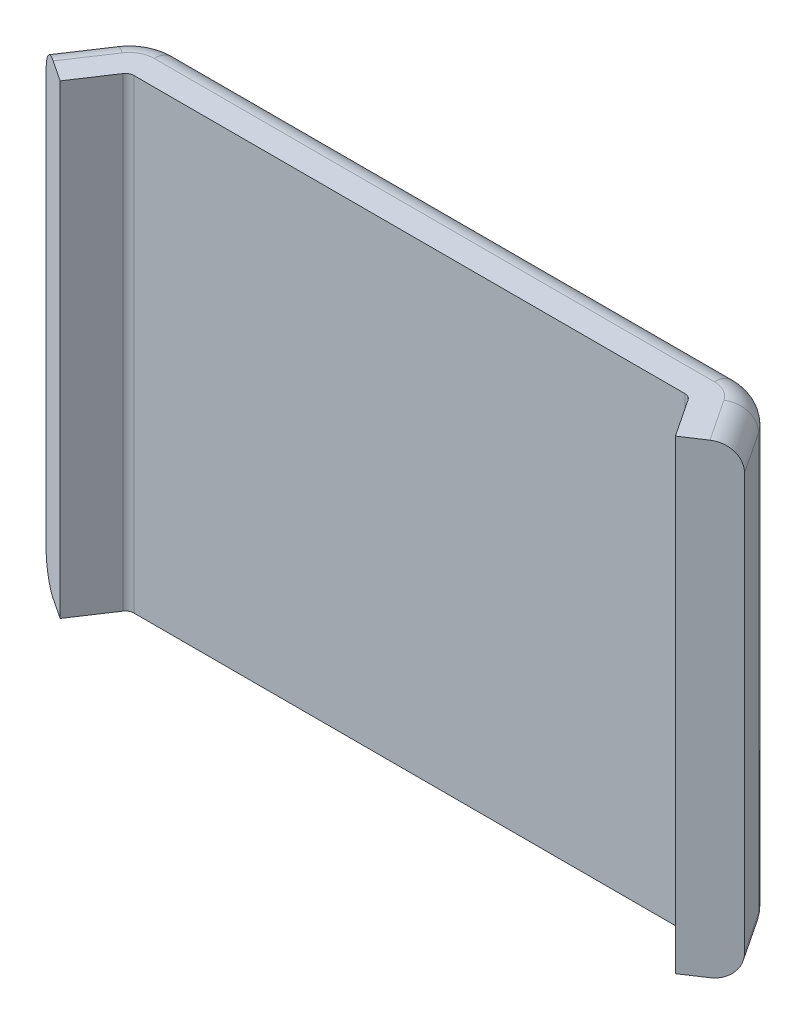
SolidWorks part; units mm, degrees
other "Solid1"
ref_plane "Front Plane" through (0, 0, 0) normal (0, 0, 1) x (1, 0, 0)
ref_plane "Top Plane" through (0, 0, 0) normal (0, 1, 0) x (1, 0, 0)
ref_plane "Right Plane" through (0, 0, 0) normal (1, 0, 0) x (0, 0, -1)
imported_body "Imported1"
sketch "Sketch1" plane through (0, 0, -2.75) normal (0, 0, -1) x (-1, 0, 0)
  line L0 (-16.8417, -0.25) -> (16.8417, -0.25) construction
  line L1 (-16.8417, 12.5) -> (-16.8417, -12.5) construction
  line L2 (16.8417, -12.5) -> (16.8417, 12.5) construction
  line L3 (-16.8417, -14) -> (16.8417, -14) construction
  text T0 "GreenLab" font "Copperplate Gothic Bold" height 2.5
  dimension "D1" = 13.75
extrude "Cut-Extrude1" cut sketch "Sketch1" against normal blind 0.5
